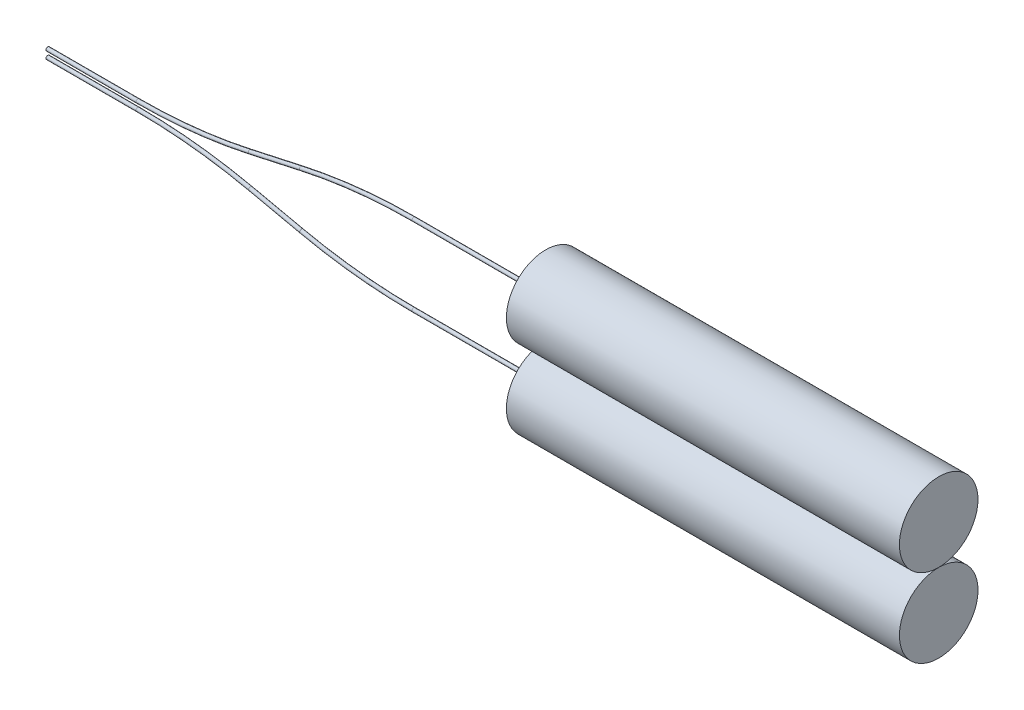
SolidWorks part; units mm, degrees
ref_plane "Vorne" through (0, 0, 0) normal (0, 0, 1) x (1, 0, 0)
ref_plane "Oben" through (0, 0, 0) normal (0, 1, 0) x (1, 0, 0)
ref_plane "Rechts" through (0, 0, 0) normal (1, 0, 0) x (0, 0, -1)
sketch "Skizze1" plane through (18, 0, 0) normal (1, 0, 0) x (0, 0, -1)
  circle A1 centre (0, 1.5) radius 1.5
  dimension "D1" = 3
  dimension "D2" = 1.5
extrude "Linear austragen1" add sketch "Skizze1" along normal blind 15
sketch "Skizze3" plane through (0, 0, 0) normal (0, 0, 1) x (1, 0, 0)
  line L0 (-1, 0.14) -> (2.4354, 0.14)
  line L1 (-0.35, 0.14) -> (-1, 0.14) construction
  line L2 (6.7266, 0.6058) -> (8.677, 1.0342)
  line L4 (18, 1.5) -> (12.9681, 1.5)
  line L5 (18, 3) -> (18, 0) construction
  arc A0 (2.4354, 0.14) -> (6.7266, 0.6058) centre (2.4354, 20.14) ccw
  arc A1 (12.9681, 1.5) -> (8.677, 1.0342) centre (12.9681, -18.5) ccw
  dimension "D1" = 20
  dimension "D2" = 1
sketch "Skizze4" plane through (-1, 0, 0) normal (-1, 0, 0) x (0, 0, 1)
  circle A0 centre (0, 0.14) radius 0.07
  dimension "D1" = 0.14
sweep "Austragung1" add profiles "Skizze4" path "Skizze3"
mirror "Spiegeln3" about plane through (0, 0, 0) normal (0, 1, 0)
